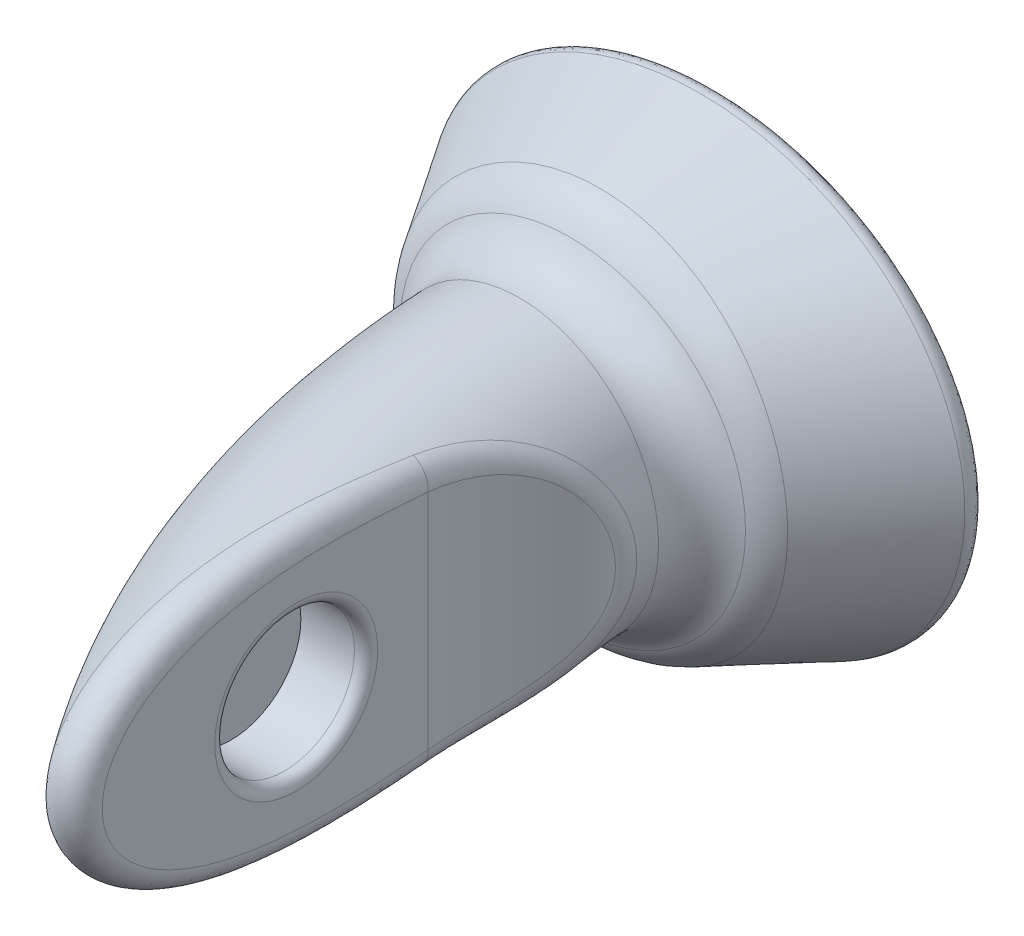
SolidWorks part; units mm, degrees
ref_plane "Front Plane" through (0, 0, 0) normal (0, 0, 1) x (1, 0, 0)
ref_plane "Top Plane" through (0, 0, 0) normal (0, 1, 0) x (1, 0, 0)
ref_plane "Right Plane" through (0, 0, 0) normal (1, 0, 0) x (0, 0, -1)
sketch "Sketch1" plane through (0, 0, 0) normal (0, 0, 1) x (1, 0, 0)
  circle A0 centre (0, 0) radius 19.05
  dimension "D1" = 38.1
sketch "Sketch2" plane through (0, 0, 0) normal (0, 1, 0) x (1, 0, 0)
  line L1 (0, 0) -> (0, -68.8809) construction
  arc A0 (0, 0) -> (29.1058, -76.2) centre (114.3, 0) ccw
  dimension "D1" = 114.3
  dimension "D2" = 76.2
sweep "Sweep1" add profiles "Sketch1" path "Sketch2"
sketch "Sketch3" plane through (0, 0, 0) normal (0, 1, 0) x (1, 0, 0)
  line L0 (12.7, -86.3693) -> (12.7, -32.8341)
  line L3 (19.05, 0) -> (-19.05, 0) construction
  arc A0 (12.7, -32.8341) -> (19.9005, -12.7) centre (44.45, -32.8341) cw
  arc A1 (19.05, 0) -> (43.3048, -63.5) centre (114.3, 0) ccw construction
  arc A2 (-19.05, 0) -> (14.9068, -88.9) centre (114.3, 0) ccw construction
  dimension "D1" = 31.75
  dimension "D2" = 12.7
  dimension "D3" = 12.7
extrude "Cut-Extrude1" cut sketch "Sketch3" against normal through all and the other way through all flip side to cut
ref_plane "Plane1" through (0, 0, -19.05) normal (0, 0, -1) x (-1, 0, 0)
sketch "Sketch4" plane through (0, 0, -19.05) normal (0, 0, -1) x (-1, 0, 0)
  line L0 (0, 0) -> (0, 31.75) construction
  line L1 (0, 0) -> (38.1, 0) construction
  ellipse E0 centre (0, 0) end of major axis (38.1, 0) minor radius 31.75
  dimension "D1" = 31.75
  dimension "D2" = 38.1
sketch "Sketch5" plane through (0, 0, 0) normal (0, 0, -1) x (-1, 0, 0)
  circle A0 centre (0, 0) radius 25.4
  dimension "D1" = 50.8
loft "Loft1" add profiles "Sketch5", "Sketch4"
sketch "Sketch6" plane through (12.7, 0, 0) normal (1, 0, 0) x (0, 0, -1)
  line L0 (0, 0) -> (-93.463, 0) construction
  line L1 (19.05, -31.75) -> (19.05, 31.75) construction
  circle A0 centre (-50.8, 0) radius 9.525
  dimension "D1" = 19.05
  dimension "D2" = 69.85
extrude "Cut-Extrude2" cut sketch "Sketch6" against normal blind 8.89
fillet "Fillet1" radius 7.62 1 edges at (19.05, 0, 0)
fillet "Fillet2" radius 7.62 1 edges at (-25.4, 0, 0)
fillet "Fillet3" radius 3.175 2 edges at (19.8348, -1.6974, 12.7803) (12.7, 4.382, -85.5785)
fillet "Fillet4" radius 1.5875 2 edges at (-38.1, 0, -19.05) (12.7, 0, 41.275)
